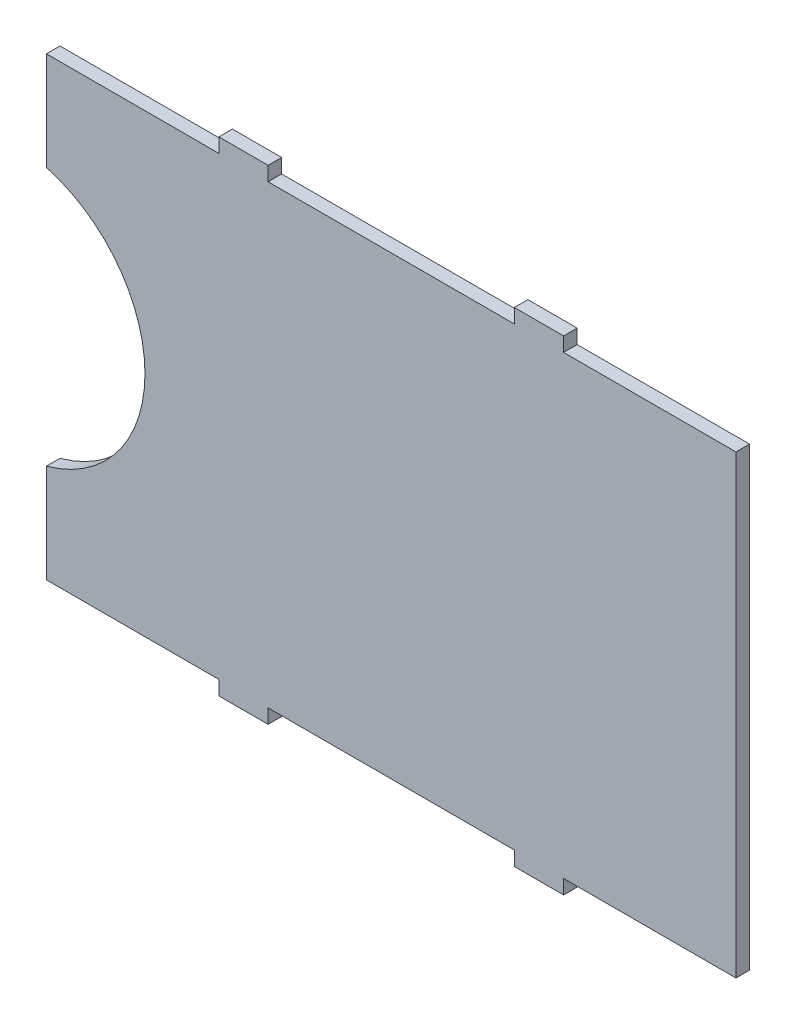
SolidWorks part; units mm, degrees
ref_plane "Alzado" through (0, 0, 0) normal (0, 0, 1) x (1, 0, 0)
ref_plane "Planta" through (0, 0, 0) normal (0, 1, 0) x (1, 0, 0)
ref_plane "Vista lateral" through (0, 0, 0) normal (1, 0, 0) x (0, 0, -1)
sketch "Croquis2" plane through (0, 0, 0) normal (0, 0, 1) x (1, 0, 0)
  line L0 (0, 0) -> (0, 185)
  line L1 (0, 185) -> (70, 185)
  line L2 (70, 185) -> (70, 190.8)
  line L3 (70, 190.8) -> (90, 190.8)
  line L4 (90, 190.8) -> (90, 185)
  line L5 (90, 185) -> (190, 185)
  line L6 (190, 185) -> (190, 190.8)
  line L7 (190, 190.8) -> (210, 190.8)
  line L8 (210, 190.8) -> (210, 185)
  line L9 (210, 185) -> (280, 185)
  line L10 (280, 185) -> (280, 0)
  line L11 (280, 0) -> (210, 0)
  line L12 (210, 0) -> (210, -5.8)
  line L13 (210, -5.8) -> (190, -5.8)
  line L14 (190, -5.8) -> (190, 0)
  line L15 (190, 0) -> (90, 0)
  line L16 (90, 0) -> (90, -5.8)
  line L17 (90, -5.8) -> (70, -5.8)
  line L18 (70, -5.8) -> (70, 0)
  line L19 (70, 0) -> (0, 0)
  dimension "D1" = 280
  dimension "D2" = 70
  dimension "D3" = 70
  dimension "D4" = 20
  dimension "D5" = 5.8
  dimension "D7" = 70
  dimension "D8" = 70
  dimension "D9" = 5.8
extrude "Saliente-Extruir1" add sketch "Croquis2" along normal blind 5.5
sketch "Croquis3" plane through (0, 0, 5.5) normal (0, 0, 1) x (1, 0, 0)
  line L0 (0, 185) -> (0, 0) construction
  line L1 (0, 145) -> (0, 40)
  arc A0 (0, 145) -> (0, 40) centre (-14.4531, 92.5) cw
  point P3 (40, 92.5)
  dimension "D1" = 40
  dimension "D2" = 40
  dimension "D3" = 40
extrude "Cortar-Extruir1" cut sketch "Croquis3" against normal blind 5.5
